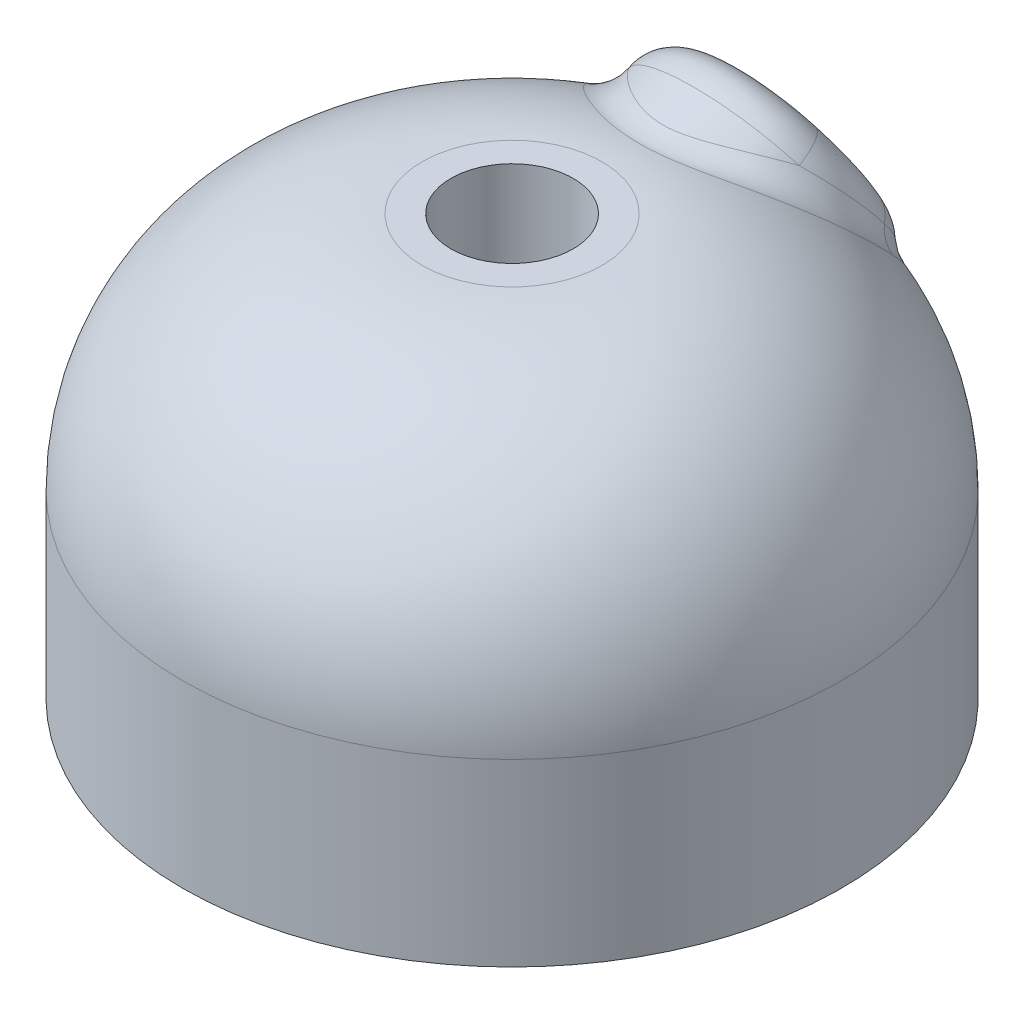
SolidWorks part; units mm, degrees
ref_plane "Front Plane" through (0, 0, 0) normal (0, 0, 1) x (1, 0, 0)
ref_plane "Top Plane" through (0, 0, 0) normal (0, 1, 0) x (1, 0, 0)
ref_plane "Right Plane" through (0, 0, 0) normal (1, 0, 0) x (0, 0, -1)
sketch "Sketch1" plane through (0, 0, 0) normal (0, 1, 0) x (1, 0, 0)
  line L1 (0, 13.8564) -> (-12, 6.9282)
  line L2 (-12, 6.9282) -> (-12, -6.9282)
  line L3 (-12, -6.9282) -> (0, -13.8564)
  line L4 (0, -13.8564) -> (12, -6.9282)
  line L5 (12, -6.9282) -> (12, 6.9282)
  line L6 (12, 6.9282) -> (0, 13.8564)
  circle A0 centre (0, 0) radius 12 construction
  circle A1 centre (0, 0) radius 27.5
  dimension "D1" = 24
  dimension "D2" = 55
extrude "Boss-Extrude1" add sketch "Sketch1" along normal blind 35
sketch "Sketch2" plane through (0, 35, 0) normal (0, 1, 0) x (1, 0, 0)
  circle A0 centre (0, 0) radius 25
extrude "Boss-Extrude2" add sketch "Sketch2" against normal blind 9
fillet "Fillet1" radius 20 1 edges at (0, 35, 27.5)
sketch "Sketch3" plane through (0, 35, 0) normal (0, 1, 0) x (1, 0, 0)
  circle A0 centre (0, 0) radius 5.1
  dimension "D1" = 10.2
extrude "Cut-Extrude1" cut sketch "Sketch3" against normal through all
sketch "Sketch4" plane through (0, 0, 0) normal (1, 0, 0) x (0, 0, -1)
  line L0 (0, 0) -> (0, 35) construction
  line L1 (5.1, 35) -> (-5.1, 35) construction
  line L2 (21.0881, 29.6752) -> (0, 17.5) construction
  line L3 (15.0303, 26.1777) -> (10.5441, 33.948)
  line L4 (10.5441, 33.948) -> (17.7256, 38.0943)
  line L5 (17.7256, 38.0943) -> (22.2118, 30.324)
  line L6 (15.0303, 26.1777) -> (22.2118, 30.324)
  arc A0 (27.5, 15) -> (7.5, 35) centre (7.5, 15) ccw construction
  dimension "D1" = 60
revolve "Revolve1" add sketch "Sketch4" angle 360 about L2
fillet "Fillet2" radius 3 1 edges at (5.8724, 33.446, -14.0519)
sketch "Sketch6" plane through (0, 17.199, -29.7895) normal (0, 0.5, -0.866) x (-1, 0, 0)
  circle A0 centre (0, 15.1554) radius 4.5
  dimension "D1" = 9
extrude "Cut-Extrude2" cut sketch "Sketch6" against normal blind 19
fillet "Fillet3" radius 3 2 edges at (0, 22.5537, -26.698) (0, 38.0943, -17.7256)
